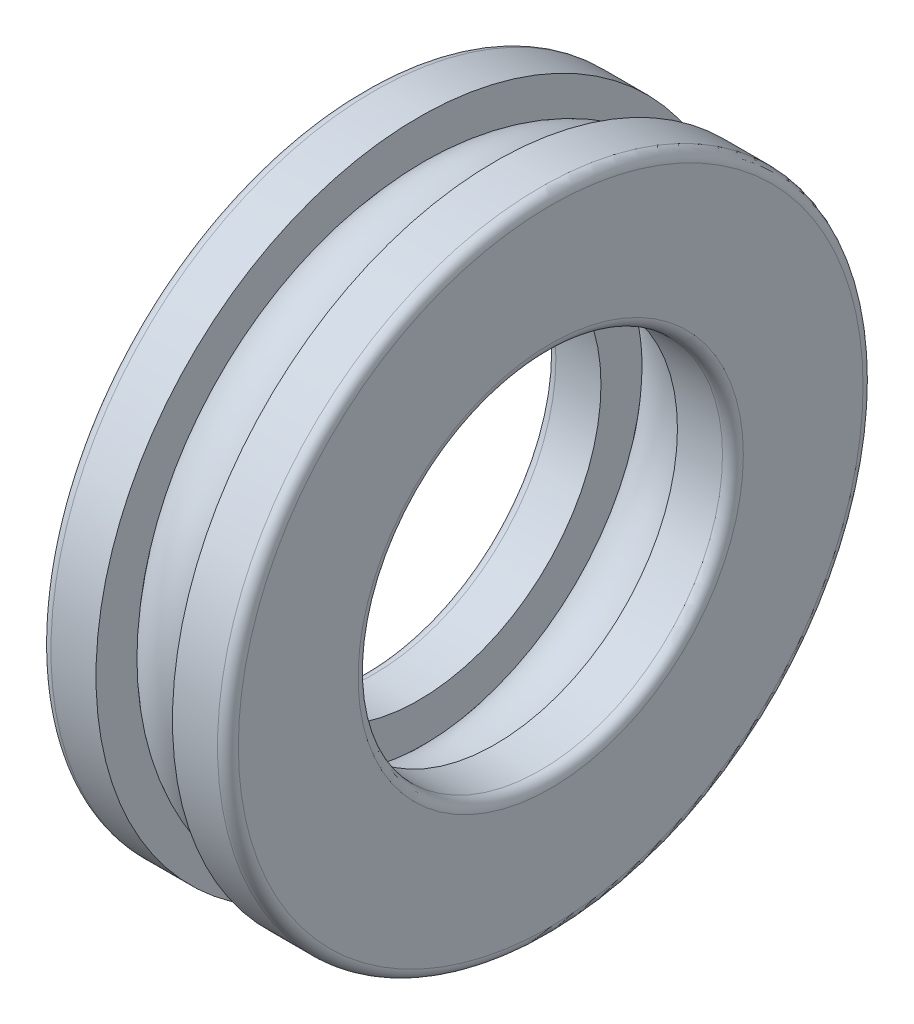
SolidWorks part; units mm, degrees
other "<thrust ball bearing_68_as>-<Mirror1>"
ref_plane "Front Plane" through (0, 0, 0) normal (0, 0, 1) x (1, 0, 0)
ref_plane "Top Plane" through (0, 0, 0) normal (0, 1, 0) x (1, 0, 0)
ref_plane "Right Plane" through (0, 0, 0) normal (1, 0, 0) x (0, 0, -1)
inserted part "thrust ball bearing_68_as"
scale "Scale1" scale about centroid uniform scaling yes scale factor 0.5
